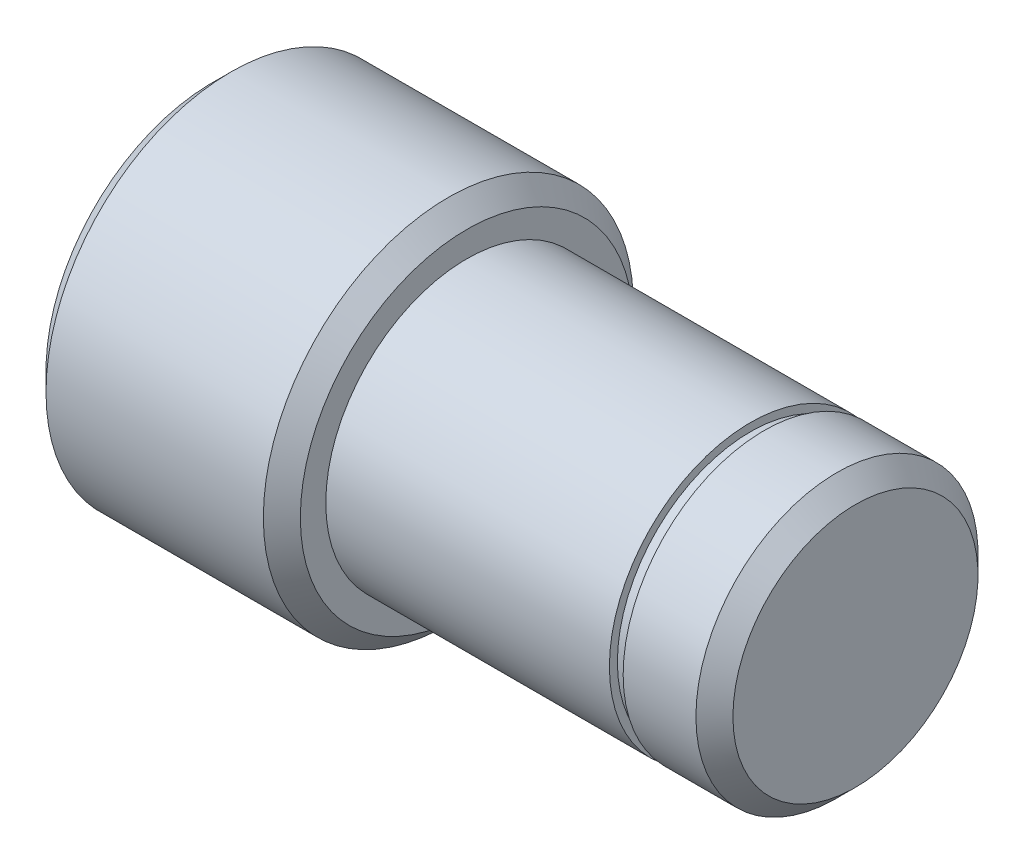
SolidWorks part; units mm, degrees
ref_plane "Front Plane" through (0, 0, 0) normal (0, 0, 1) x (1, 0, 0)
ref_plane "Top Plane" through (0, 0, 0) normal (0, 1, 0) x (1, 0, 0)
ref_plane "Right Plane" through (0, 0, 0) normal (1, 0, 0) x (0, 0, -1)
sketch "Sketch1" plane through (0, 0, 0) normal (0, 0, 1) x (1, 0, 0)
  line L0 (0, 0) -> (74.679, 0) construction
  line L1 (0, 0) -> (0, 25.4)
  line L2 (0, 25.4) -> (34.925, 25.4)
  line L3 (34.925, 25.4) -> (34.925, 19.3675)
  line L4 (34.925, 19.3675) -> (88.2904, 19.3675)
  line L5 (88.2904, 19.3675) -> (88.2904, 0)
  line L6 (0, 0) -> (88.2904, 0)
  dimension "D1" = 34.925
  dimension "D2" = 88.2904
  dimension "D3" = 38.735
  dimension "D4" = 50.8
revolve "Revolve1" add sketch "Sketch1" angle 360 about L0
chamfer "Chamfer1" distance 2.54 angle 45 3 edges at (0, 0, 25.4) (88.2904, 0, 19.3675) (34.925, 0, 25.4)
sketch "Sketch2" plane through (0, 0, 0) normal (-1, 0, 0) x (0, 0, 1)
  circle A0 centre (0, 0) radius 19.05 construction
  circle A1 centre (19.05, 0) radius 2.413
  circle A2 centre (-19.05, 0) radius 2.413
  dimension "D1" = 38.1
  dimension "D2" = 4.826
extrude "Cut-Extrude1" cut sketch "Sketch2" against normal blind 6.35
sketch "Sketch3" plane through (0, 0, 0) normal (-1, 0, 0) x (0, 0, 1)
  circle A0 centre (0, -8.3566) radius 3.175
  dimension "D2" = 6.35
  dimension "D1" = 8.3566
extrude "Cut-Extrude2" cut sketch "Sketch3" against normal blind 6.35
sketch "Sketch4" plane through (0, 0, 0) normal (0, 1, 0) x (1, 0, 0)
  line L0 (85.7504, 19.3675) -> (34.925, 19.3675) construction
  line L1 (73.8694, 19.3675) -> (75.76, 19.3675)
  line L2 (73.8694, 19.3675) -> (73.8694, 18.2689)
  line L3 (73.8694, 18.2689) -> (75.76, 18.2689)
  line L4 (75.76, 19.3675) -> (75.76, 18.2689)
revolve "Cut-Revolve1" cut sketch "Sketch4" angle 360 about axis through (0, 0, 0) along (1, 0, 0)
